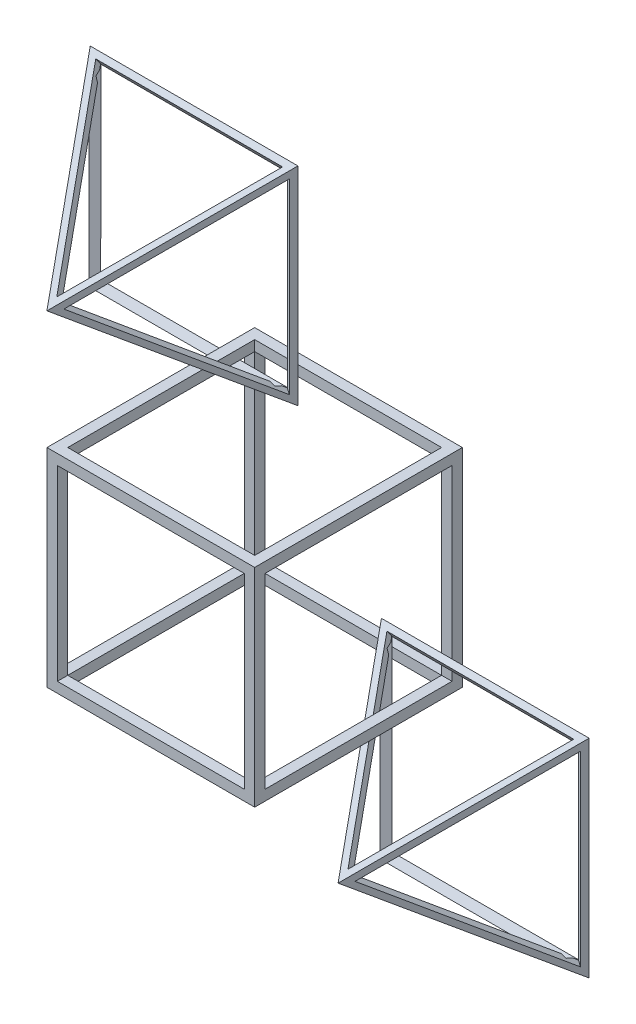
SolidWorks part; units mm, degrees
ref_plane "Front Plane" through (0, 0, 0) normal (0, 0, 1) x (1, 0, 0)
ref_plane "Top Plane" through (0, 0, 0) normal (0, 1, 0) x (1, 0, 0)
ref_plane "Right Plane" through (0, 0, 0) normal (1, 0, 0) x (0, 0, -1)
other "Join1"
other "triangle<1>@Assem2"
other "square<1>@Assem2"
other "triangle<2>@Assem2"
